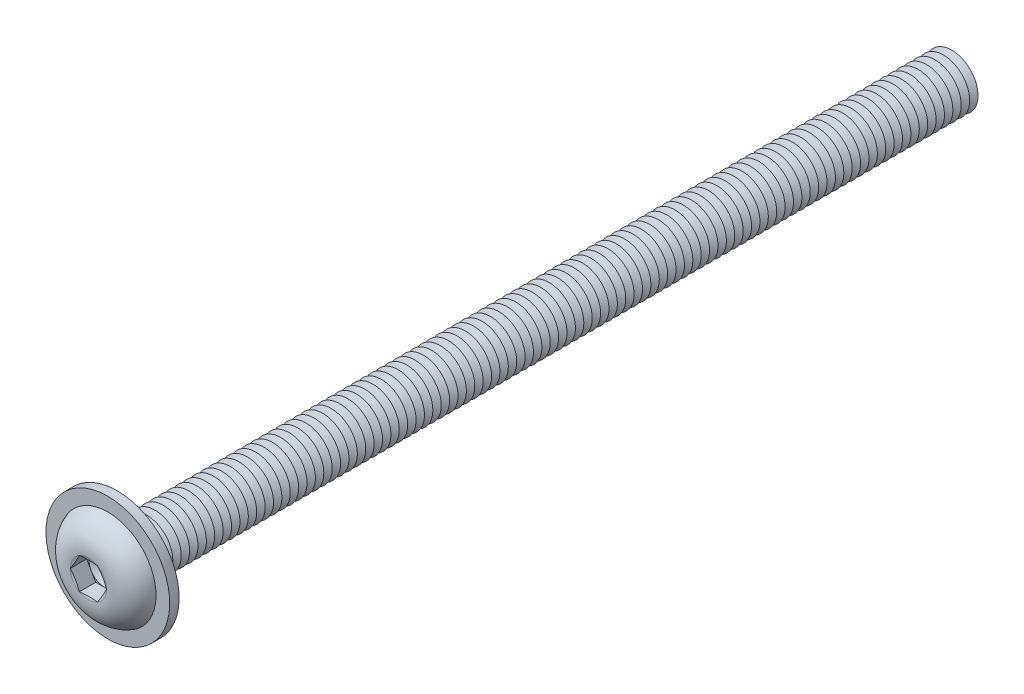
SolidWorks part; units mm, degrees
ref_plane "Front Plane" through (0, 0, 0) normal (0, 0, 1) x (1, 0, 0)
ref_plane "Top Plane" through (0, 0, 0) normal (0, 1, 0) x (1, 0, 0)
ref_plane "Right Plane" through (0, 0, 0) normal (1, 0, 0) x (0, 0, -1)
sketch "Sketch1" plane through (0, 0, 0) normal (1, 0, 0) x (0, 0, -1)
  line L0 (0, 2.5) -> (0, 4.75)
  line L3 (0, 2.5) -> (80, 2.5)
  line L4 (80, 2.5) -> (80, 0)
  line L5 (80, 0) -> (-2.75, 0) construction
  line L6 (-2.75, 0) -> (80, 0)
  line L7 (-2.75, 1.732) -> (-2.75, 0.866) construction
  line L8 (-2.75, 0.866) -> (-2.75, 0)
  line L9 (-2.75, 1.732) -> (-2.5179, 0.866)
  line L10 (-2.5179, 0.866) -> (-2.75, 0.866)
  line L11 (80, 0) -> (22.7481, 0) construction
  line L12 (0, 4.75) -> (-2.75, 4.75) construction
  arc A1 (0, 4.75) -> (-2.75, 1.732) centre (0, 1.9881) ccw
  point P8 (80, 1.25)
  dimension "D1" = 9.5
  dimension "D2" = 5
  dimension "D3" = 2.75
  dimension "D4" = 3.4641
  dimension "D5" = 80
  dimension "D6" = 15
revolve "Revolve1" add sketch "Sketch1" angle 360 about L5
fillet "Fillet1" radius 0.4 1 edges at (0, 2.5, 0)
sketch "Sketch2" plane through (0, 0, 0) normal (1, 0, 0) x (0, 0, -1)
  line L0 (79.6, 2.5) -> (80.4, 2.5)
  line L1 (80, 2.5) -> (0.4, 2.5) construction
  line L2 (80.4, 2.5) -> (80, 1.8072)
  line L3 (80, -2.5) -> (80, 2.5) construction
  line L4 (80, 1.8072) -> (79.6, 2.5)
  dimension "D1" = 0.8
revolve "Cut-Revolve1" cut sketch "Sketch2" angle 360 about axis through (0, 0, -80) along (0, 0, -1)
pattern_linear "LPattern1" count 100 spacing 0.8 along (0, 0, 1) of "Cut-Revolve1"
sketch "Sketch3" plane through (0, 0, 2.75) normal (0, 0, 1) x (1, 0, 0)
  line L7 (0.866, 1.5) -> (-0.866, 1.5)
  line L8 (-0.866, 1.5) -> (-1.7321, 0)
  line L9 (-1.7321, 0) -> (-0.866, -1.5)
  line L10 (-0.866, -1.5) -> (0.866, -1.5)
  line L11 (0.866, -1.5) -> (1.732, 0)
  line L12 (1.732, 0) -> (0.866, 1.5)
  circle A0 centre (0, 0) radius 1.5 construction
  circle A3 centre (0, 0) radius 1.7321 construction
extrude "Cut-Extrude1" cut sketch "Sketch3" against normal blind 1.56
sketch "Sketch4" plane through (0, 0, 1.19) normal (0, 0, 1) x (1, 0, 0)
  line L1 (0.866, 1.5) -> (-0.866, 1.5) construction
  circle A0 centre (0, 0) radius 1.5
extrude "Cut-Extrude2" cut sketch "Sketch4" against normal through all draft 60
sketch "Sketch5" plane through (0, 0, 0) normal (0, 0, -1) x (-1, 0, 0)
  circle A0 centre (0, 0) radius 5.9
  circle A1 centre (0, 0) radius 2.9
  circle A2 centre (0, 0) radius 2.9 construction
  dimension "D1" = 11.8
extrude "Boss-Extrude1" add sketch "Sketch5" against normal blind 0.9
